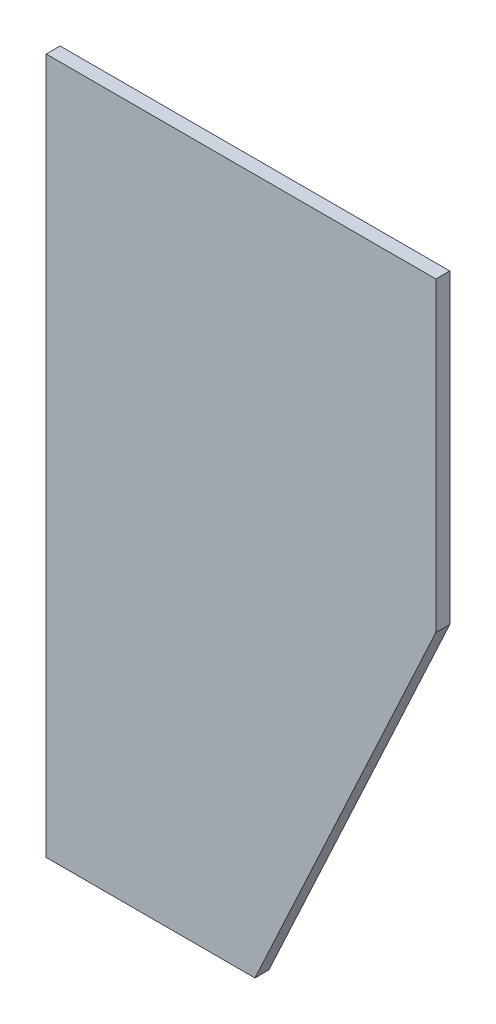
SolidWorks part; units mm, degrees
ref_plane "Plan de face" through (0, 0, 0) normal (0, 0, 1) x (1, 0, 0)
ref_plane "Plan de dessus" through (0, 0, 0) normal (0, 1, 0) x (1, 0, 0)
ref_plane "Plan de droite" through (0, 0, 0) normal (1, 0, 0) x (0, 0, -1)
sketch "Esquisse1" plane through (0, 0, 0) normal (0, 0, 1) x (1, 0, 0)
  line L0 (0, 0) -> (0, 500)
  line L1 (0, 500) -> (280, 500)
  line L2 (280, 500) -> (280, 280)
  line L3 (280, 280) -> (150, 0)
  line L4 (150, 0) -> (0, 0)
  dimension "D1" = 500
  dimension "D2" = 280
  dimension "D3" = 220
  dimension "D4" = 150
extrude "Boss.-Extru.1" add sketch "Esquisse1" along normal blind 10
